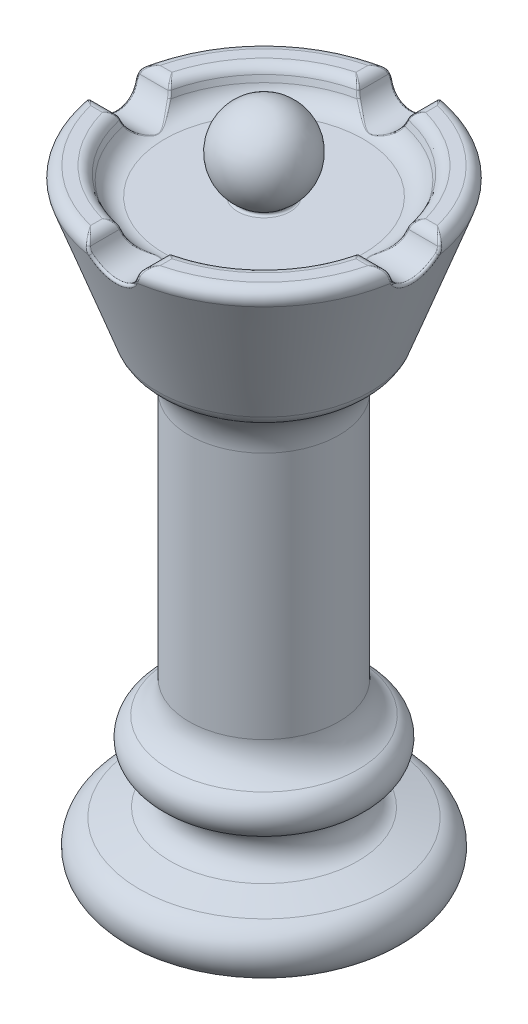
SolidWorks part; units mm, degrees
ref_plane "Front" through (0, 0, 0) normal (0, 0, 1) x (1, 0, 0)
ref_plane "Top" through (0, 0, 0) normal (0, 1, 0) x (1, 0, 0)
ref_plane "Right" through (0, 0, 0) normal (1, 0, 0) x (0, 0, -1)
sketch "Sketch1" plane through (0, 0, 0) normal (0, 0, 1) x (1, 0, 0)
  line L0 (0, 0) -> (0, 72.0534) construction
  line L1 (0, 0) -> (13.97, 0)
  line L2 (14.8003, 5.9807) -> (11.1344, 7.0186)
  line L3 (8.89, 20.2472) -> (8.89, 49.7112)
  line L4 (12.6183, 56.0518) -> (18.796, 73.025)
  line L5 (18.796, 73.025) -> (14.732, 73.025)
  line L6 (0, 69.85) -> (0, 0)
  line L7 (14.732, 73.025) -> (14.1847, 71.5213)
  line L8 (11.7979, 69.85) -> (0, 69.85)
  arc A0 (13.97, 0) -> (14.8003, 5.9807) centre (13.97, 3.048) ccw
  arc A1 (11.1344, 7.0186) -> (10.941, 11.8433) centre (11.8263, 9.4625) cw
  arc A2 (10.941, 11.8433) -> (11.2008, 16.4912) centre (10.0557, 14.224) ccw
  arc A3 (11.2008, 16.4912) -> (8.89, 20.2472) centre (13.0979, 20.2472) cw
  arc A4 (8.89, 49.7112) -> (11.6298, 54.8002) centre (14.986, 49.7112) cw
  arc A5 (11.7979, 69.85) -> (14.1847, 71.5213) centre (11.7979, 72.39) ccw
  arc A6 (12.6183, 56.0518) -> (11.6298, 54.8002) centre (10.2315, 56.9206) cw
  dimension "D2" = 3.048
  dimension "D4" = 2.54
  dimension "D5" = 2.54
  dimension "D7" = 8.89
  dimension "D8" = 4.064
  dimension "D9" = 3.175
  dimension "D11" = 6.096
  dimension "D12" = 14.224
  dimension "D13" = 29.464
  dimension "D14" = 13.97
  dimension "D15" = 11.8263
  dimension "D16" = 4.2079
  dimension "D3" = 3.81
  dimension "D6" = 69.85
  dimension "D10" = 110
  dimension "D17" = 18.796
revolve "Base-Revolve" add sketch "Sketch1" angle 360 about L0
sketch "Sketch2" plane through (0, 73.025, 0) normal (0, 1, 0) x (-1, 0, 0)
  line L0 (0, 0) -> (0, 21.3897) construction
  line L2 (0, 18.796) -> (-3.048, 18.796)
  line L3 (0, 18.796) -> (0, 12.446)
  line L4 (0, 12.446) -> (-3.048, 12.446)
  line L5 (-3.048, 18.796) -> (-3.048, 12.446)
  circle A1 centre (0, 0) radius 18.796 construction
  dimension "D1" = 3.048
  dimension "D2" = 6.35
revolve "Cut-Revolve1" cut sketch "Sketch2" angle 360 about L0
pattern_circular "CirPattern1" count 4 over 360 about axis through (0, 0, 0) along (0, 1, 0) of "Cut-Revolve1"
sketch "Sketch3" plane through (0, 0, 0) normal (0, 0, 1) x (1, 0, 0)
  line L0 (0, 69.9924) -> (0, 86.3357) construction
  line L2 (0, 0) -> (0, 72.0534) construction
  line L3 (0, 79.502) -> (0, 69.342)
  line L4 (11.7979, 69.85) -> (-11.7979, 69.85) construction
  arc A0 (0, 69.342) -> (0, 79.502) centre (0, 74.422) ccw
  dimension "D1" = 5.08
  dimension "D2" = 4.572
revolve "Boss-Revolve1" add sketch "Sketch3" angle 360 about L0
fillet "Fillet1" radius 1.27 24 edges at (-10.4171, 73.025, 10.4171) (-13.2908, 73.025, 13.2908) (3.048, 73.025, 16.4802) (-0.4065, 70.0042, 17.6919) (-3.048, 73.025, 16.4802) (-2.8751, 72.0129, 14.073) (10.4171, 73.025, 10.4171) (13.2908, 73.025, 13.2908) (16.4802, 73.025, -3.048) (17.6919, 70.0042, 0.4065) (16.4802, 73.025, 3.048) (14.073, 72.0129, 2.8751) (10.4171, 73.025, -10.4171) (13.2908, 73.025, -13.2908) (-3.048, 73.025, -16.4802) (0.4065, 70.0042, -17.6919) (3.048, 73.025, -16.4802) (2.8751, 72.0129, -14.073) (-10.4171, 73.025, -10.4171) (-13.2908, 73.025, -13.2908) (-16.4802, 73.025, 3.048) (-17.6919, 70.0042, -0.4065) (-16.4802, 73.025, -3.048) (-14.073, 72.0129, -2.8751)
fillet "Fillet2" radius 0.254 49 edges at (14.5078, 72.8022, 3.4085) (14.5078, 72.8022, -3.4085) (17.4071, 72.7802, 3.3775) (17.4071, 72.7802, -3.3775) (3.4085, 72.8022, -14.5078) (-3.4085, 72.8022, -14.5078) (3.3775, 72.7802, -17.4071) (-3.3775, 72.7802, -17.4071) (-14.5078, 72.8022, -3.4085) (-14.5078, 72.8022, 3.4085) (-17.4071, 72.7802, 3.3775) (-17.4071, 72.7802, -3.3775) (-3.3775, 72.7802, 17.4071) (3.3775, 72.7802, 17.4071) (-3.4085, 72.8022, 14.5078) (3.4085, 72.8022, 14.5078) (17.6919, 70.0042, 0.4065) (18.0436, 71.6947, 2.7424) (12.6031, 69.9814, 0.1631) (18.0406, 71.7572, -2.7718) (0.4065, 70.0042, -17.6919) (2.7424, 71.6947, -18.0436) (0.1631, 69.9814, -12.6031) (-2.7718, 71.7572, -18.0406) (-18.0436, 71.6947, -2.7424) (-12.6031, 69.9814, -0.1631) (-18.0406, 71.7572, 2.7718) (-17.6919, 70.0042, -0.4065) (-0.1631, 69.9814, 12.6031) (2.7718, 71.7572, 18.0406) (-0.4065, 70.0042, 17.6919) (-2.7424, 71.6947, 18.0436) (0, 69.85, 2.2143)
